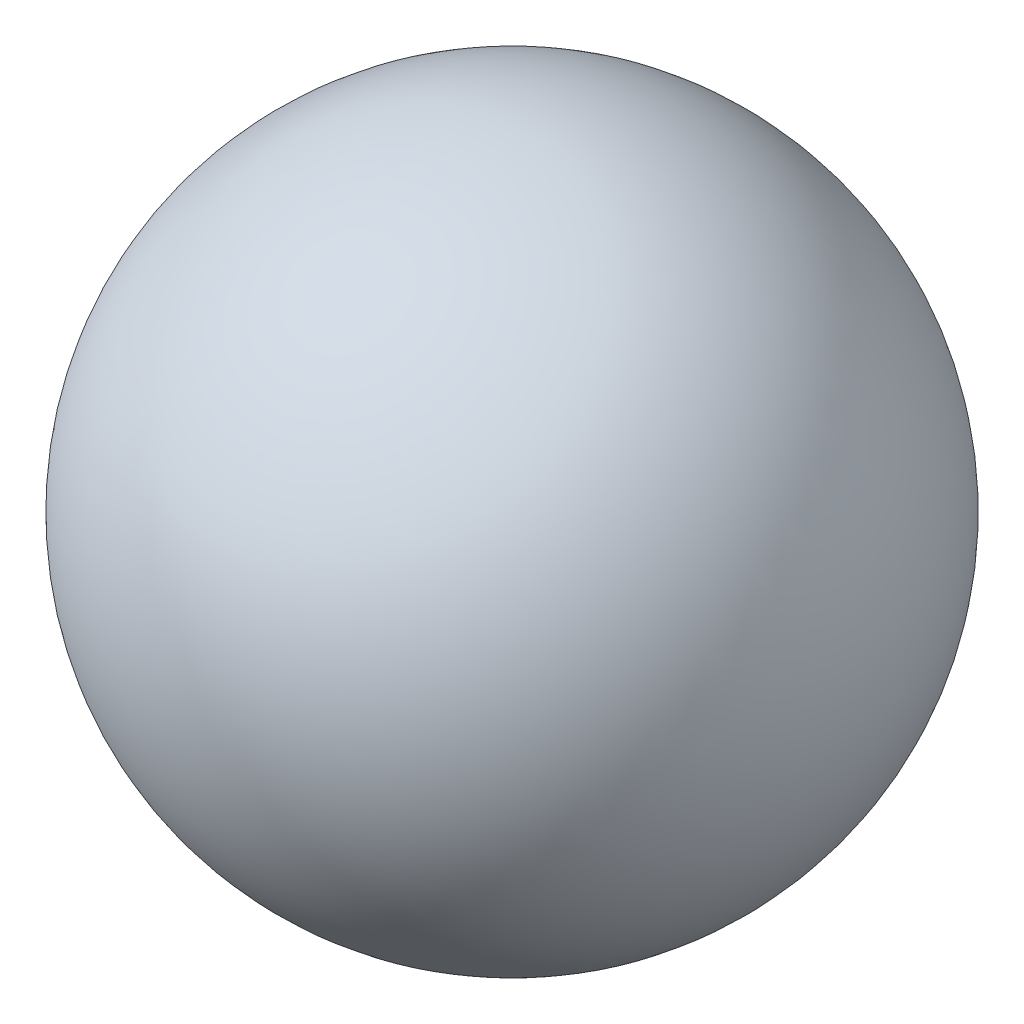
SolidWorks part; units mm, degrees
ref_plane "Plano frontal" through (0, 0, 0) normal (0, 0, 1) x (1, 0, 0)
ref_plane "Plano superior" through (0, 0, 0) normal (0, 1, 0) x (1, 0, 0)
ref_plane "Plano direito" through (0, 0, 0) normal (1, 0, 0) x (0, 0, -1)
sketch "Esboço1" plane through (0, 0, 0) normal (0, 0, 1) x (1, 0, 0)
  line L0 (0, 21.3) -> (0, -21.3) construction
  line L1 (0, 21.3) -> (0, -21.3)
  arc A0 (0, 21.3) -> (0, -21.3) centre (0, 0) cw
  dimension "D1" = 42.6
revolve "Revolução1" add sketch "Esboço1" angle 360 about L0
